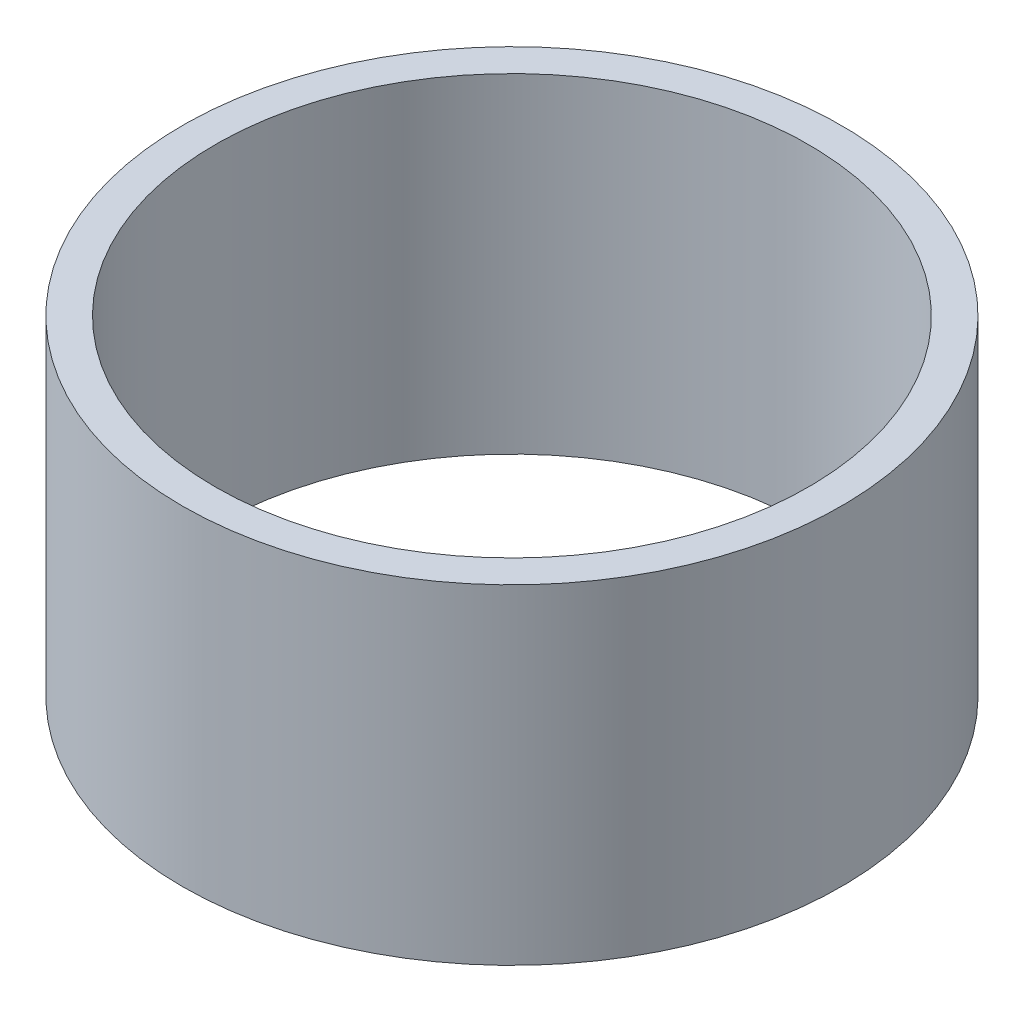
SolidWorks part; units mm, degrees
ref_plane "Ebene vorne" through (0, 0, 0) normal (0, 0, 1) x (1, 0, 0)
ref_plane "Ebene oben" through (0, 0, 0) normal (0, 1, 0) x (1, 0, 0)
ref_plane "Ebene rechts" through (0, 0, 0) normal (1, 0, 0) x (0, 0, -1)
sketch "Skizze1" plane through (0, 0, 0) normal (0, 1, 0) x (1, 0, 0)
  circle A0 centre (0, 0) radius 100
  circle A1 centre (0, 0) radius 90
  dimension "D1" = 200
  dimension "D2" = 10
extrude "Linear austragen1" add sketch "Skizze1" along normal mid plane 100
